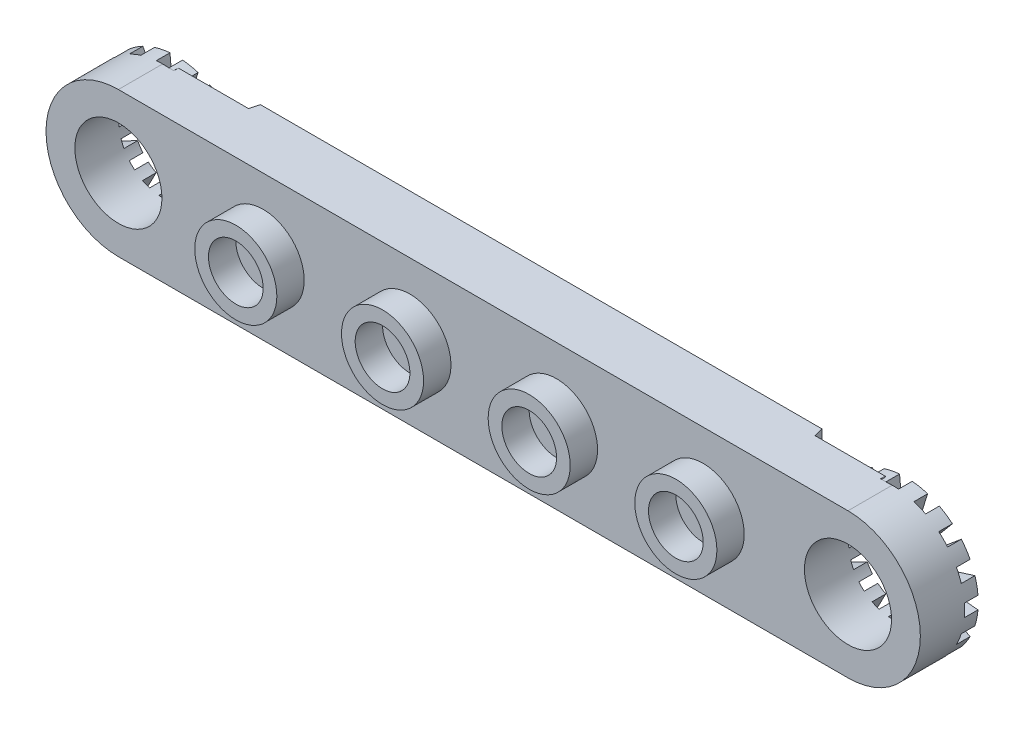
SolidWorks part; units mm, degrees
ref_plane "Front Plane" through (0, 0, 0) normal (0, 0, 1) x (1, 0, 0)
ref_plane "Top Plane" through (0, 0, 0) normal (0, 1, 0) x (1, 0, 0)
ref_plane "Right Plane" through (0, 0, 0) normal (1, 0, 0) x (0, 0, -1)
sketch "Sketch1" plane through (0, 0, 0) normal (0, 0, 1) x (1, 0, 0)
  line L0 (20, 3.9688) -> (-20, 3.9688)
  line L1 (0, 0) -> (0, 100.65) construction
  line L2 (0, 0) -> (108.9, 0) construction
  line L3 (-20, -3.9687) -> (20, -3.9688)
  arc A0 (20, 3.9688) -> (20, -3.9688) centre (20, 0) cw
  arc A1 (-20, 3.9688) -> (-20, -3.9687) centre (-20, 0) ccw
  circle A2 centre (-20, 0) radius 2.3876
  circle A3 centre (20, 0) radius 2.3876
  dimension "D3" = 4.7752
  dimension "D1" = 40
  dimension "D2" = 7.9375
extrude "Extrude1" add sketch "Sketch1" along normal mid plane 2.413
sketch "Sketch2" plane through (0, 0, 1.2065) normal (0, 0, 1) x (1, 0, 0)
  circle A0 centre (-12.0625, 0) radius 2.25
  circle A1 centre (12.0625, 0) radius 2.25
  circle A2 centre (-20, 0) radius 2.3876 construction
  circle A3 centre (20, 0) radius 2.3876 construction
  dimension "D1" = 4.5
  dimension "D2" = 7.9375
  dimension "D3" = 7.9375
extrude "Extrude-Thin1" add sketch "Sketch2" along normal blind 1.5 thin
sketch "Sketch3" plane through (0, 0, -1.2065) normal (0, 0, -1) x (-1, 0, 0)
  line L0 (-20, 3.9688) -> (20, 3.9688) construction
  line L1 (-15.3962, 3.9688) -> (15.3962, 3.9688)
  line L2 (-15.3962, 3.9688) -> (-15.3962, -3.9688)
  line L3 (-15.3962, -3.9688) -> (15.3962, -3.9688)
  line L4 (15.3962, 3.9688) -> (15.3962, -3.9688)
  line L5 (20, -3.9688) -> (-20, -3.9688) construction
  line L6 (0, -10.9375) -> (0, 8.6806) construction
  circle A0 centre (-20, 0) radius 2.3876 construction
  dimension "D1" = 4.6038
extrude "Extrude2" add sketch "Sketch3" along normal blind 0.762
chamfer "Chamfer1" distance 0.2 distance2 0.76 2 edges
sketch "Sketch4" plane through (0, 0, -1.9685) normal (0, 0, -1) x (-1, 0, 0)
  line L0 (15.5962, 2.4688) -> (16.8925, 2.4688)
  line L1 (15.5962, 3.9688) -> (15.5962, -3.9687) construction
  line L2 (16.8925, -2.4688) -> (15.5962, -2.4688)
  line L3 (15.5962, 3.9688) -> (20, 3.9688) construction
  line L4 (20, -3.9688) -> (15.5962, -3.9688) construction
  line L5 (15.5962, 2.4688) -> (15.5962, -2.4688)
  line L6 (14.8962, 2.4688) -> (14.8962, -2.4688)
  line L8 (14.8962, 2.4688) -> (9.3962, 2.4688)
  line L9 (14.8962, -2.4688) -> (9.3962, -2.4688)
  line L10 (9.3962, -2.4688) -> (9.3962, 2.4688)
  line L11 (8.5462, 2.4688) -> (8.5462, -2.4688)
  line L12 (8.5462, 2.4688) -> (2.4099, 2.4688)
  line L13 (8.5462, -2.4688) -> (2.4099, -2.4688)
  arc A0 (16.8925, 2.4688) -> (16.8925, -2.4688) centre (20, 0) ccw
  arc A1 (20, -3.9688) -> (20, 3.9688) centre (20, 0) ccw construction
  circle A2 centre (0, 0) radius 3.45 construction
  arc A3 (2.4099, 2.4688) -> (2.4099, -2.4688) centre (0, 0) cw
  dimension "D5" = 6.9
  dimension "D1" = 1.5
  dimension "D2" = 1.5
  dimension "D3" = 0.7
  dimension "D4" = 5.5
  dimension "D6" = 0.85
extrude "Cut-Extrude1" cut sketch "Sketch4" against normal blind 1.5
mirror "Mirror1" about plane through (0, 0, 0) normal (1, 0, 0) of "Cut-Extrude1"
sketch "Sketch5" plane through (0, 0, 1.2065) normal (0, 0, 1) x (1, 0, 0)
  line L0 (0, 10.9809) -> (0, -10.6771) construction
  line L1 (-14.1059, 0) -> (14.9306, 0) construction
  line L2 (0.922, 2.1833) -> (0.922, 0.922)
  line L3 (0.922, 0.922) -> (2.1833, 0.922)
  line L4 (2.1833, -0.922) -> (0.922, -0.922)
  line L5 (0.922, -0.922) -> (0.922, -2.1833)
  line L6 (-0.922, -2.1833) -> (-0.922, -0.922)
  line L7 (-0.922, -0.922) -> (-2.1833, -0.922)
  line L8 (-2.1833, 0.922) -> (-0.922, 0.922)
  line L9 (-0.922, 0.922) -> (-0.922, 2.1833)
  circle A0 centre (0, 0) radius 2.37 construction
  arc A1 (-0.922, 2.1833) -> (0.922, 2.1833) centre (0, 0.0087) cw
  arc A2 (-2.1833, 0.922) -> (-2.1833, -0.922) centre (-0.0087, 0) ccw
  arc A3 (2.1833, 0.922) -> (2.1833, -0.922) centre (0.0087, 0) cw
  arc A4 (-0.922, -2.1833) -> (0.922, -2.1833) centre (0, -0.0087) ccw
  dimension "D5" = 4.74
  dimension "D6" = 2.362
  dimension "D7" = 2.362
  dimension "D8" = 2.362
  dimension "D9" = 2.362
  dimension "D1" = 0.922
  dimension "D2" = 0.922
  dimension "D3" = 0.922
  dimension "D4" = 0.922
sketch "Sketch6" plane through (0, 0, -1.2065) normal (0, 0, -1) x (-1, 0, 0)
  line L0 (-19.37, 3.9688) -> (-15.3962, 3.9688)
  line L1 (-15.3962, 3.9688) -> (-15.3962, 2.4688)
  line L2 (-15.3962, 2.4688) -> (-16.8925, 2.4688)
  line L3 (-16.8925, -2.4688) -> (-15.3962, -2.4688)
  line L4 (-15.3962, -2.4688) -> (-15.3962, -3.9688)
  line L5 (-15.3962, -3.9688) -> (-19.37, -3.9688)
  line L9 (-15.3962, 3.9688) -> (-15.3962, -3.9688) construction
  line L10 (-15.3962, 3.9688) -> (-15.3962, -3.9688) construction
  arc A0 (-16.8925, 2.4688) -> (-19.374, 3.9191) centre (-20, 0) ccw
  arc A1 (-16.8925, -2.4688) -> (-16.8925, 2.4688) centre (-20, 0) ccw construction
  arc A2 (-16.8925, -2.4688) -> (-19.374, -3.9191) centre (-20, 0) cw
  arc A3 (-16.8925, -2.4688) -> (-16.8925, 2.4688) centre (-20, 0) ccw construction
  arc A4 (-19.374, -3.9191) -> (-19.37, -3.9688) centre (-19.37, -3.9438) ccw
  arc A5 (-19.374, 3.9191) -> (-19.37, 3.9688) centre (-19.37, 3.9438) cw
  point P30 (-20, -3.9688)
  point P33 (-20, 3.9688)
  dimension "D1" = 0.025
extrude "Extrude3" add sketch "Sketch6" along normal blind 0.25
sketch "Sketch7" plane through (0, 0, -1.2065) normal (0, 0, -1) x (-1, 0, 0)
  circle A0 centre (-20, 0) radius 3.9688
  arc A1 (-20, 3.9688) -> (-20, -3.9688) centre (-20, 0) ccw construction
  circle A2 centre (-20, 0) radius 2.3876
  circle A3 centre (-20, 0) radius 2.3876 construction
extrude "Extrude4" add sketch "Sketch7" along normal up to surface (0.762 mm away)
sketch "Sketch8" plane through (0, 0, -1.9685) normal (0, 0, -1) x (-1, 0, 0)
  line L0 (-20, 5.2243) -> (-20, 0) construction
  line L1 (-20, 0) -> (-19.4716, 6.0392) construction
  line L2 (-20, 0) -> (-20.4267, 4.8769) construction
  line L3 (-20.2081, 2.3785) -> (-20.3459, 3.9536)
  line L4 (-19.7919, 2.3785) -> (-19.6541, 3.9536)
  circle A1 centre (-20, 0) radius 2.3876 construction
  arc A2 (-20.3459, 3.9536) -> (-19.6541, 3.9536) centre (-20, 0) cw
  arc A3 (-20.2081, 2.3785) -> (-19.7919, 2.3785) centre (-20, 0) cw
  circle A4 centre (-20, 0) radius 3.9688 construction
  dimension "D1" = 5
  dimension "D2" = 5
extrude "Cut-Extrude3" cut sketch "Sketch8" against normal blind 0.75
pattern_circular "CirPattern1" count 16 over 360 about axis through (20, 0, 0) along (0, 0, 1) of "Cut-Extrude3"
mirror "Mirror2" about plane through (0, 0, 0) normal (1, 0, 0) of "CirPattern1", "Cut-Extrude3", "Extrude4", "Extrude3"
sketch "Sketch9" plane through (0, 0, 1.2065) normal (0, 0, 1) x (1, 0, 0)
  line L0 (-20, 0) -> (22.7817, 0) construction
sketch "Sketch10" plane through (0, 0, 1.2065) normal (0, 0, 1) x (1, 0, 0)
  line L0 (-20, 0) -> (22.7817, 0) construction
  circle A0 centre (-4.0175, 0) radius 2.25
  circle A1 centre (4.0225, 0) radius 2.25
  circle A2 centre (-12.0625, 0) radius 2.25 construction
extrude "Extrude5" add sketch "Sketch10" along normal blind 1.5
sketch "Sketch11" plane through (0, 0, 2.7065) normal (0, 0, 1) x (1, 0, 0)
  line L0 (-6.9268, 0) -> (8.1954, 0) construction
sketch "Sketch12" plane through (0, 0, 2.7065) normal (0, 0, 1) x (1, 0, 0)
  circle A0 centre (-4.0175, 0) radius 1.5
  circle A1 centre (4.0225, 0) radius 1.5
  circle A2 centre (-4.0175, 0) radius 2.25 construction
  circle A3 centre (4.0225, 0) radius 2.25 construction
  circle A4 centre (-12.0625, 0) radius 1.5 construction
extrude "Extrude6" cut sketch "Sketch12" against normal blind 1.5
sketch "Sketch13" plane through (0, 0, -1.9685) normal (0, 0, -1) x (-1, 0, 0)
  line L0 (-8.5462, 2.4688) -> (-2.4099, 2.4688) construction
  line L1 (-4.8329, 2.4688) -> (4.1821, 2.4688)
  line L2 (-4.8329, 2.4688) -> (-4.8329, -2.4688)
  line L3 (-4.8329, -2.4688) -> (4.1821, -2.4688)
  line L4 (4.1821, 2.4688) -> (4.1821, -2.4688)
  line L5 (2.4099, -2.4688) -> (8.5462, -2.4688) construction
extrude "Extrude7" cut sketch "Sketch13" against normal blind 1.5
